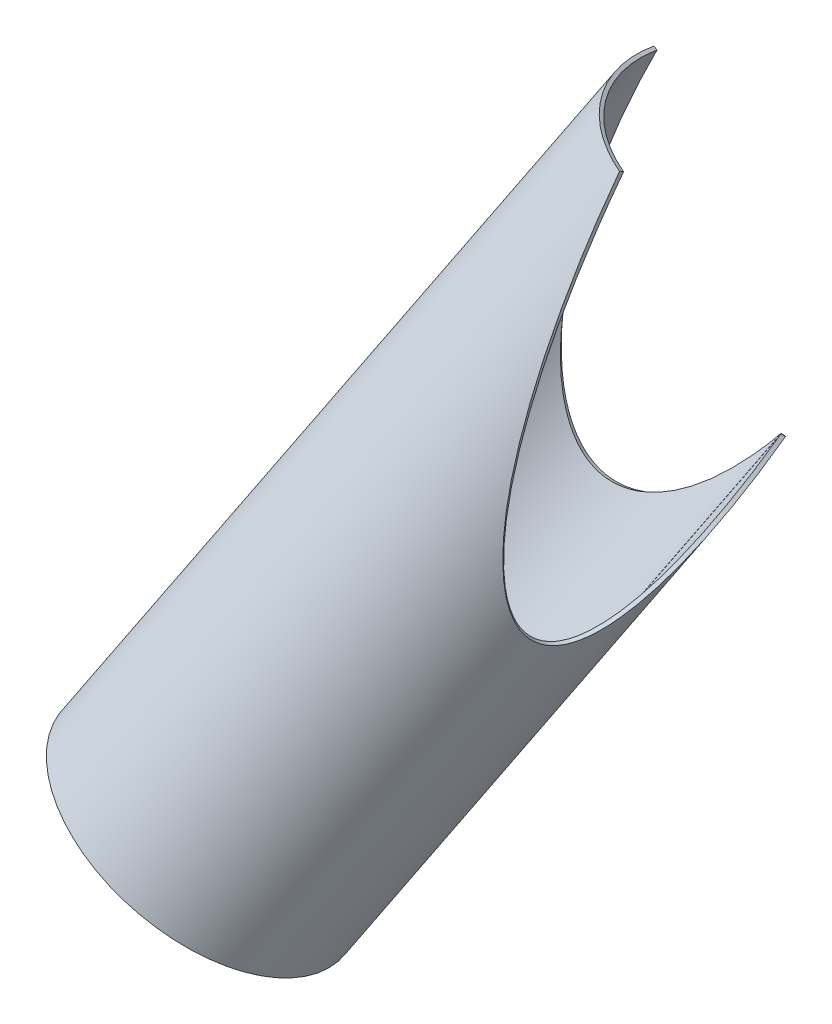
SolidWorks part; units mm, degrees
ref_plane "前视基准面" through (0, 0, 0) normal (0, 0, 1) x (1, 0, 0)
ref_plane "上视基准面" through (0, 0, 0) normal (0, 1, 0) x (1, 0, 0)
ref_plane "右视基准面" through (0, 0, 0) normal (1, 0, 0) x (0, 0, -1)
imported_body "基体零件-等径Y形五通管-1"
sheet metal parameters "钣金1" parameters "D1"=0.7366, "厚度"=6
bend "圆角折弯1" bend radius 204 bend angle 359.727 parameters "D5"=1
flatten bends "展开-折弯1" parameters "D1"=0
sketch "尖角-草图1" plane through (-197.5163, -748.5111, 144.122) normal (0.6756, -0.5528, -0.4879) x (-0.3776, 0.309, -0.8729)
  line L0 (-758.5632, -171.0222) -> (-430.2037, 647.7588) construction
process bends "加工-折弯1" parameters "D1"=0
sketch "平面-草图1" plane through (-197.5163, -748.5111, 144.122) normal (0.6756, -0.5528, -0.4879) x (-0.3776, 0.309, -0.8729)
